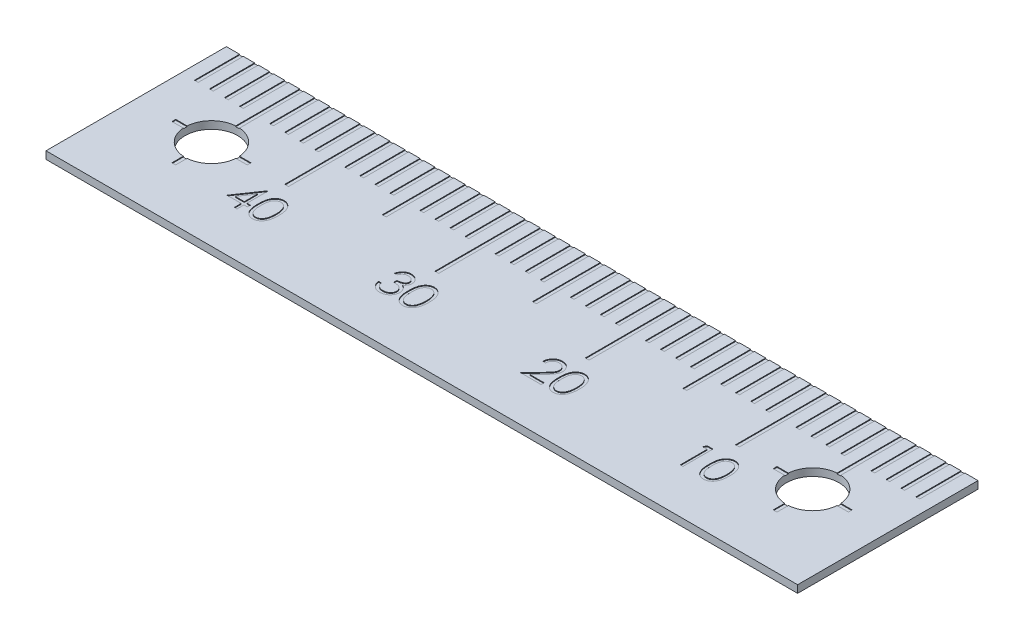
SolidWorks part; units mm, degrees
ref_plane "Front Plane" through (0, 0, 0) normal (0, 0, 1) x (1, 0, 0)
ref_plane "Top Plane" through (0, 0, 0) normal (0, 1, 0) x (1, 0, 0)
ref_plane "Right Plane" through (0, 0, 0) normal (1, 0, 0) x (0, 0, -1)
sketch "Sketch1" plane through (0, 0, 0) normal (0, 1, 0) x (1, 0, 0)
  line L1 (-25, 6) -> (25, 6)
  line L2 (-25, 6) -> (-25, -6)
  line L3 (-25, -6) -> (25, -6)
  line L4 (25, 6) -> (25, -6)
extrude "Boss-Extrude1" add sketch "Sketch1" against normal blind 0.5
sketch "Sketch2" plane through (0, 0, 0) normal (0, 1, 0) x (1, 0, 0)
  line L1 (-24.125, 3) -> (-23.875, 3)
  line L2 (-24.125, 3) -> (-24.125, 6)
  line L3 (-24.125, 6) -> (-23.875, 6)
  line L4 (-23.875, 3) -> (-23.875, 6)
  line L5 (-24, 6) -> (-24, 3) construction
  line L6 (-25, 6) -> (-25, -6) construction
  dimension "D1" = 3
  dimension "D2" = 0.25
  dimension "D3" = 1
extrude "Cut-Extrude2" cut sketch "Sketch2" against normal blind 0.05 contours L4 L3 L2 L1
pattern_linear "LPattern2" count 49 spacing 1 along (1, 0, 0) of "Cut-Extrude2"
sketch "Sketch3" plane through (0, 0, 0) normal (0, 1, 0) x (1, 0, 0)
  line L0 (-15.125, 3) -> (-15.125, 6) construction
  line L6 (-15.125, 3) -> (-14.875, 3)
  line L7 (-15.125, 3) -> (-15.125, 0)
  line L8 (-15.125, 0) -> (-14.875, 0)
  line L9 (-14.875, 3) -> (-14.875, 0)
  dimension "D1" = 0
  dimension "D2" = 0.25
  dimension "D4" = 3
extrude "Cut-Extrude3" cut sketch "Sketch3" against normal blind 0.05
pattern_linear "LPattern3" count 4 spacing 10 along (1, 0, 0) of "Cut-Extrude3"
sketch "Sketch4" plane through (0, 0, 0) normal (0, 1, 0) x (1, 0, 0)
  line L0 (-10.125, 3) -> (-10.125, 6) construction
  line L1 (-10.125, 3) -> (-9.875, 3)
  line L2 (-10.125, 3) -> (-10.125, 1.5)
  line L3 (-10.125, 1.5) -> (-9.875, 1.5)
  line L4 (-9.875, 3) -> (-9.875, 1.5)
  dimension "D1" = 0
  dimension "D2" = 0.25
  dimension "D3" = 3
  dimension "D4" = 1.5
extrude "Cut-Extrude4" cut sketch "Sketch4" against normal blind 0.05
pattern_linear "LPattern4" count 4 spacing 10 along (1, 0, 0) count 2 spacing 10 along (-1, 0, 0) of "Cut-Extrude4"
sketch "Sketch5" plane through (0, 0, 0) normal (0, 1, 0) x (1, 0, 0)
  line L0 (-19.995, 0) -> (-19.995, 2.5) construction
  line L1 (-19.995, 0) -> (-19.995, -2.5) construction
  line L2 (-19.995, 0) -> (-17.495, 0) construction
  line L3 (-19.995, 0) -> (-22.495, 0) construction
  line L5 (-20.12, 2.5) -> (-19.87, 2.5)
  line L6 (-20.12, 2.5) -> (-20.12, 1.7455)
  line L7 (-20.12, -2.5) -> (-19.87, -2.5)
  line L8 (-19.87, 2.5) -> (-19.87, 1.7455)
  line L9 (-22.495, 0.125) -> (-21.7405, 0.125)
  line L10 (-22.495, 0.125) -> (-22.495, -0.125)
  line L11 (-22.495, -0.125) -> (-21.7405, -0.125)
  line L12 (-17.495, 0.125) -> (-17.495, -0.125)
  line L13 (-23.125, 6) -> (-23.875, 6) construction
  line L14 (-20.12, 1.4948) -> (-20.12, 0.125)
  line L15 (-19.87, 1.4948) -> (-19.87, 0.125)
  line L16 (-18.2495, 0.125) -> (-17.495, 0.125)
  line L17 (-18.2495, -0.125) -> (-17.495, -0.125)
  line L18 (-19.87, -1.7455) -> (-19.87, -2.5)
  line L19 (-20.12, -1.7455) -> (-20.12, -2.5)
  line L20 (-21.4898, -0.125) -> (-20.12, -0.125)
  line L21 (-21.4898, 0.125) -> (-20.12, 0.125)
  line L22 (-19.87, -0.125) -> (-19.87, -1.4948)
  line L23 (-19.87, 0.125) -> (-18.5002, 0.125)
  line L24 (-20.12, -0.125) -> (-20.12, -1.4948)
  line L25 (-19.87, -0.125) -> (-18.5002, -0.125)
  arc A0 (-20.12, 1.4948) -> (-21.4898, 0.125) centre (-19.995, 0) ccw
  arc A1 (-20.12, 1.7455) -> (-21.7405, 0.125) centre (-19.995, 0) ccw
  arc A2 (-18.5002, 0.125) -> (-19.87, 1.4948) centre (-19.995, 0) ccw
  arc A3 (-18.2495, 0.125) -> (-19.87, 1.7455) centre (-19.995, 0) ccw
  arc A4 (-19.87, -1.4948) -> (-18.5002, -0.125) centre (-19.995, 0) ccw
  arc A5 (-19.87, -1.7455) -> (-18.2495, -0.125) centre (-19.995, 0) ccw
  arc A6 (-21.4898, -0.125) -> (-20.12, -1.4948) centre (-19.995, 0) ccw
  arc A7 (-21.7405, -0.125) -> (-20.12, -1.7455) centre (-19.995, 0) ccw
  point P34 (-19.995, 2.5)
extrude "Cut-Extrude6" cut sketch "Sketch5" against normal blind 0.05
pattern_linear "LPattern5" count 2 spacing 40 along (1, 0, 0) of "Cut-Extrude6"
sketch "Sketch7" plane through (0, 0, 0) normal (0, 1, 0) x (1, 0, 0)
  line L0 (-25, -6) -> (25, -6) construction
  line L1 (-25, 6) -> (-25, -6) construction
  text T0 "10         20         30         40" font "Century Gothic" height 2
  dimension "D1" = 3
  dimension "D2" = 8.5
extrude "Cut-Extrude7" [suppressed] cut sketch "Sketch7" against normal blind 0.05
sketch "Sketch11" plane through (0, 0, 0) normal (0, 1, 0) x (1, 0, 0)
  line L0 (-25, -6) -> (25, -6) construction
  line L1 (-25, 6) -> (-25, -6) construction
  text T0 "50         60         70         80         90" font "Century Gothic" height 2
  dimension "D1" = 3
  dimension "D2" = 48.5
extrude "Cut-Extrude8" [suppressed] cut sketch "Sketch11" against normal blind 0.05
sketch "Sketch14" plane through (0, 0, 0) normal (0, 1, 0) x (1, 0, 0)
  line L0 (-25, -6) -> (25, -6) construction
  line L1 (-25, 6) -> (-25, -6) construction
  text T0 "100       110       120       130       140" font "Century Gothic" height 2
  dimension "D1" = 3
  dimension "D2" = 97.5
extrude "Cut-Extrude10" [suppressed] cut sketch "Sketch14" against normal blind 0.05
sketch "Sketch15" plane through (0, 0, 0) normal (0, 1, 0) x (1, 0, 0)
  line L0 (-25, 6) -> (-25, -6) construction
  line L1 (-25, -6) -> (25, -6) construction
  text T0 "40         30         20         10" font "Century Gothic" height 2
  dimension "D1" = 8.5
  dimension "D2" = 3
extrude "Cut-Extrude12" cut sketch "Sketch15" against normal blind 0.05
sketch "Sketch18" plane through (0, 0, 0) normal (0, 1, 0) x (1, 0, 0)
  line L0 (-25, -6) -> (25, -6) construction
  line L1 (-25, 6) -> (-25, -6) construction
  text T0 "90         80         70         60         50" font "Century Gothic" height 2
  dimension "D1" = 3
  dimension "D2" = 8.5
extrude "Cut-Extrude13" [suppressed] cut sketch "Sketch18" against normal blind 0.05
sketch "Sketch19" plane through (0, 0, 0) normal (0, 1, 0) x (1, 0, 0)
  line L0 (-25, 6) -> (-25, -6) construction
  line L1 (-25, -6) -> (25, -6) construction
  text T0 "140       130       120       110       100" font "Century Gothic" height 2
  dimension "D1" = 7.5
  dimension "D2" = 3
extrude "Cut-Extrude14" [suppressed] cut sketch "Sketch19" against normal blind 0.05
sketch "Sketch20" plane through (0, 0, 0) normal (0, 1, 0) x (1, 0, 0)
  circle A0 centre (-19.995, 0) radius 1.75
extrude "Cut-Extrude15" cut sketch "Sketch20" against normal blind 0.5
pattern_linear "LPattern6" count 2 spacing 40 along (1, 0, 0) of "Cut-Extrude15"
sketch "Sketch21" plane through (0, 0, 0) normal (0, 1, 0) x (1, 0, 0)
  line L0 (-25, -6) -> (25, -6) construction
  line L1 (-25, 6) -> (-25, -6) construction
  text T0 "10         20         30         40         50         40         30         20         10" font "Century Gothic" height 2
  dimension "D1" = 3
  dimension "D2" = 8.5
extrude "Cut-Extrude17" [suppressed] cut sketch "Sketch21" against normal blind 0.05
sketch "Sketch22" plane through (0, 0, 0) normal (0, 1, 0) x (1, 0, 0)
  line L0 (-25, -6) -> (25, -6) construction
  line L1 (-25, 6) -> (-25, -6) construction
  text T0 "10         20         30         40         50         60         70         80         90        100        90         80         70         60         50         40         30         20         10" font "Century Gothic" height 2
  dimension "D1" = 3
  dimension "D2" = 8.5
extrude "Cut-Extrude18" [suppressed] cut sketch "Sketch22" against normal blind 0.05
sketch "Sketch23" plane through (0, 0, 0) normal (0, 1, 0) x (1, 0, 0)
  line L0 (-25, -6) -> (25, -6) construction
  line L2 (-25, 6) -> (-25, -6) construction
  text T0 "10         20         30         40         50         60         70         80         90        100       110       120       130       140       150       160       170       180       190       20" font "Century Gothic" height 2
  dimension "D1" = 3
  dimension "D2" = 8.5
extrude "Cut-Extrude19" [suppressed] cut sketch "Sketch23" against normal blind 0.05
sketch "Sketch24" plane through (0, 0, 0) normal (0, 1, 0) x (1, 0, 0)
  line L0 (-25, -6) -> (25, -6) construction
  line L1 (-25, 6) -> (-25, -6) construction
  text T0 "10         20         30         40         50         60         70         80         90        100       110       120       130       140       150       160       170       180       190" font "Century Gothic" height 2
  dimension "D1" = 3
  dimension "D2" = 8.5
extrude "Cut-Extrude20" [suppressed] cut sketch "Sketch24" against normal blind 0.05
sketch "Sketch26" plane through (0, 0, 0) normal (0, 1, 0) x (1, 0, 0)
  line L0 (-25, -6) -> (25, -6) construction
  line L1 (-25, 6) -> (-25, -6) construction
  text T0 "190       180       170       160       150       140       130       120       110       100        90         80         70         60         50         40         30         20         10" font "Century Gothic" height 2
  dimension "D1" = 3
  dimension "D2" = 7.5
extrude "Cut-Extrude21" [suppressed] cut sketch "Sketch26" against normal blind 0.05
sketch "Sketch27" plane through (0, 0, 0) normal (0, 1, 0) x (1, 0, 0)
  line L0 (-25, -6) -> (25, -6) construction
  line L1 (-25, 6) -> (-25, -6) construction
  text T0 "490       480       470       460       450       440       430       420       410       400       390       380       370       360       350       340       330       320       310       300       " font "Century Gothic" height 2
  dimension "D1" = 3
  dimension "D2" = 7.5
extrude "Cut-Extrude22" [suppressed] cut sketch "Sketch27" against normal blind 0.05
sketch "Sketch29" plane through (0, 0, 0) normal (0, 1, 0) x (1, 0, 0)
  line L0 (-25, -6) -> (25, -6) construction
  line L1 (-25, 6) -> (-25, -6) construction
  text T0 "10         20         30         40         50         60         70         80         90        100       110       120       130       140       150       160       170       180       190       20" font "Century Gothic" height 2
  dimension "D1" = 3
  dimension "D2" = 8.5
extrude "Cut-Extrude23" [suppressed] cut sketch "Sketch29" against normal blind 0.05
sketch "Sketch30" plane through (0, 0, 0) normal (0, 1, 0) x (1, 0, 0)
  line L0 (-25, -6) -> (25, -6) construction
  line L1 (-25, 6) -> (-25, -6) construction
  text T0 "240       230       220       210       200       190       180       170       160       150       140       130       120       110       100        90         80         70         60         50   " font "Century Gothic" height 2
  dimension "D1" = 3
  dimension "D2" = 7.5
extrude "Cut-Extrude24" [suppressed] cut sketch "Sketch30" against normal blind 0.05
sketch "Sketch31" [suppressed] plane through (0, 0, 0) normal (0, 1, 0) x (1, 0, 0)
  line L0 (-100, -6) -> (100, -6) construction
  line L1 (-100, 6) -> (-100, -6) construction
  text T0 "150       160       170       180       190" font "Century Gothic" height 2
  dimension "D1" = 3
  dimension "D2" = 148.5
extrude "Cut-Extrude25" [suppressed] cut sketch "Sketch31" against normal blind 0.05
sketch "Sketch32" [suppressed] plane through (0, 0, 0) normal (0, 1, 0) x (1, 0, 0)
  line L0 (-25, -6) -> (25, -6) construction
  line L1 (-24.125, -6) -> (-23.875, -6)
  line L2 (-24.125, -6) -> (-24.125, -3)
  line L3 (-24.125, -3) -> (-23.875, -3)
  line L4 (-23.875, -6) -> (-23.875, -3)
  line L5 (-24, -3) -> (-24, -6) construction
  line L6 (-25, 6) -> (-25, -6) construction
  dimension "D1" = 0.25
  dimension "D2" = 3
  dimension "D3" = 1
extrude "Cut-Extrude26" [suppressed] cut sketch "Sketch32" against normal blind 0.05
pattern_linear "LPattern7" [suppressed] count 99 spacing 1
sketch "Sketch34" [suppressed] plane through (0, 0, 0) normal (0, 1, 0) x (1, 0, 0)
  line L1 (-245.125, -3) -> (-244.875, -3)
  line L2 (-245.125, -3) -> (-245.125, -1.5)
  line L3 (-245.125, -1.5) -> (-244.875, -1.5)
  line L4 (-244.875, -3) -> (-244.875, -1.5)
  dimension "D1" = 1.5
  dimension "D2" = 0.25
extrude "Cut-Extrude27" [suppressed] cut sketch "Sketch34" against normal blind 0.05
pattern_linear "LPattern8" [suppressed] count 4 spacing 10
sketch "Sketch35" [suppressed] plane through (0, 0, 0) normal (0, 1, 0) x (1, 0, 0)
  line L1 (-240.125, -3) -> (-239.875, -3)
  line L2 (-240.125, -3) -> (-240.125, 0)
  line L3 (-240.125, 0) -> (-239.875, 0)
  line L4 (-239.875, -3) -> (-239.875, 0)
  dimension "D1" = 3
  dimension "D2" = 0.25
extrude "Cut-Extrude28" [suppressed] cut sketch "Sketch35" against normal blind 0.05
pattern_linear "LPattern9" [suppressed] count 4 spacing 10
equation "\"D2@Sketch1\"=\"D1@Sketch1\"/2"
equation "\"D4@Sketch1\"=\"D3@Sketch1\"/2"
equation "\"D8@Sketch5\"=\"D7@Sketch5\"/2"
equation "\"D10@Sketch5\"=\"D9@Sketch5\"/2"
